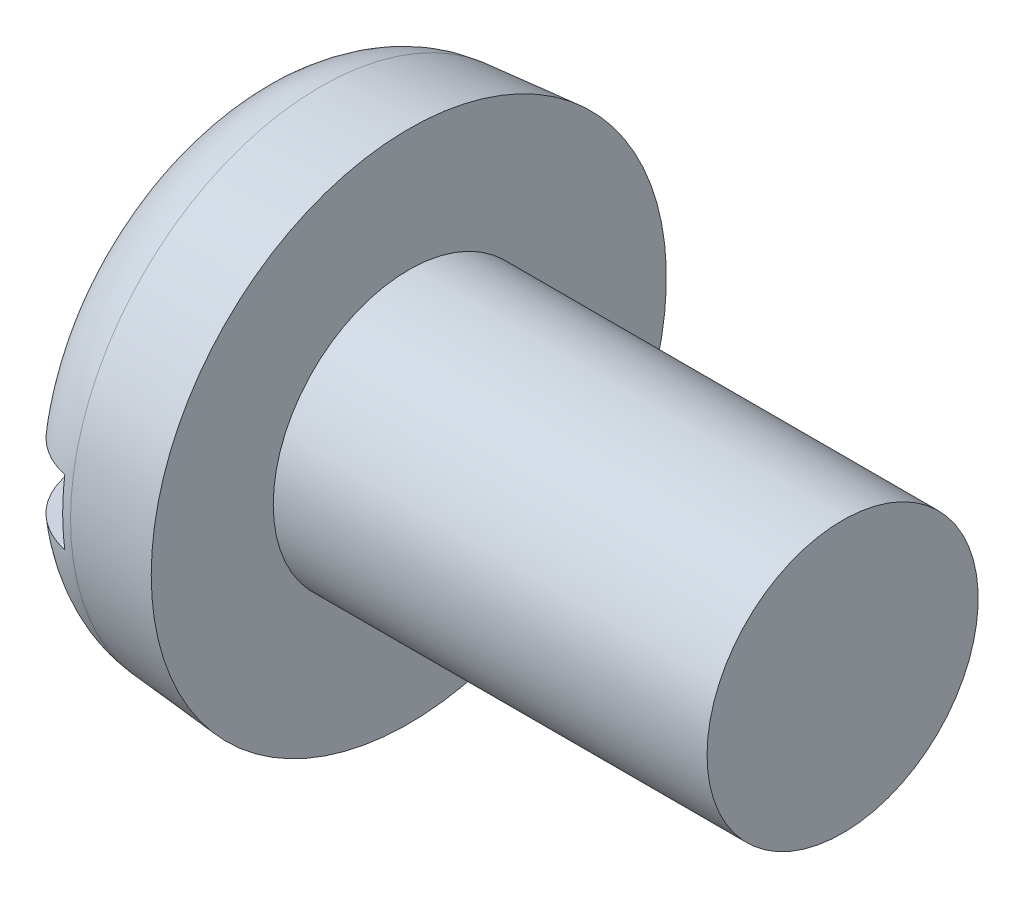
SolidWorks part; units mm, degrees
ref_plane "Plane1" through (0, 0, 0) normal (0, 0, 1) x (1, 0, 0)
ref_plane "Plane2" through (0, 0, 0) normal (0, 1, 0) x (1, 0, 0)
ref_plane "Plane3" through (0, 0, 0) normal (1, 0, 0) x (0, 0, -1)
sketch "BodySke" plane through (0, 0, 0) normal (0, 0, 1) x (1, 0, 0)
  line L0 (3, 2.5) -> (3, 4.75)
  line L1 (0, 0) -> (0, 4.4875)
  line L2 (-25.4, 0) -> (127, 0) construction
  line L3 (11, 0) -> (0, 0)
  line L4 (3, 2.5) -> (11, 2.5)
  line L5 (11, 2.5) -> (11, 0)
  line L6 (0, 4.4875) -> (3, 4.75)
  line L9 (3.8, 4.0875) -> (3.8, -5.4375) construction
  line L10 (3, 6.35) -> (3, -3.175) construction
  dimension "Head_ht" = 3
  dimension "Diameter" = 5
  dimension "Length" = 8
  dimension "Head_dia" = 9.5
  dimension "Advance" = 0.8
  dimension "Thread_nom" = 8
  dimension "Head_side_angle" = 5
revolve "Base-Revolve" add sketch "BodySke"
fillet "Fillet1" [suppressed] radius 0.2
fillet "Fillet2" radius 1.5 1 edges at (0, 0, 4.4875)
sketch "Sketch2" plane through (0, 0, 0) normal (1, 0, 0) x (0, 0, -1)
  line L0 (4.75, -0.6) -> (-4.75, -0.6)
  line L1 (4.75, -0.6) -> (4.75, 0.6)
  line L2 (-4.75, 0.6) -> (4.75, 0.6)
  line L3 (-4.75, 0.6) -> (-4.75, -0.6)
  dimension "D1" = 9.5
  dimension "D2" = 4.75
  dimension "Slot_width" = 1.2
  dimension "D3" = 0.6
extrude "Slot" cut sketch "Sketch2" along normal blind 1.2
sketch "ThdSchSke" plane through (0, 0, 0) normal (0, 0, 1) x (1, 0, 0)
  line L0 (4.6, -2.055) -> (4.2884, -2.5)
  line L1 (4.6, -2.055) -> (4.9116, -2.5)
  line L2 (4.9116, -2.5) -> (4.9116, -3.125)
  line L3 (-3.175, 0) -> (5.1513, 0) construction
  line L5 (4.9116, -3.125) -> (4.2884, -3.125)
  line L6 (4.2884, -3.125) -> (4.2884, -2.5)
  dimension "Thread_minor" = 4.11
  dimension "Diameter" = 5
  dimension "Start" = 4.6
  dimension "SideAngle" = 55
  dimension "VeeAngle" = 70
  dimension "Overcut" = 6.25
revolve "ThreadSchematic" [suppressed] cut sketch "ThdSchSke" angle 360 about L3
pattern_linear "ThdSchPat" [suppressed]
equation "\"D1@Sketch2\" = \"Head_dia@BodySke\""
equation "\"D2@Sketch2\" = \"D1@Sketch2\" / 2"
equation "\"D3@Sketch2\" = \"Slot_width@Sketch2\" / 2"
equation "\"Thread_length@ThreadCosmetic\" = ((sgn( (\"Length@BodySke\" - \"Advance@BodySke\" * 2.0 ) - \"Thread_nom@BodySke\" )-1)*( (\"Length@BodySke\" - \"Advance@BodySke\"  * 2.0) - \"Thread_nom@BodySke\" ))/-2+ \"Thread_"
equation "\"Thread_minor@ThdSchSke\" = \"Thread_minor@ThreadCosmetic\""
equation "\"Diameter@ThdSchSke\" = \"Diameter@BodySke\""
equation "\"Overcut@ThdSchSke\" = \"Diameter@BodySke\" * 1.25"
equation "\"Start@ThdSchSke\" = \"Head_ht@BodySke\" + \"Length@BodySke\" - \"Thread_length@ThreadCosmetic\"  '---Non-countersunk---"
equation "\"Num_threads@ThdSchPat\" = int( \"Thread_length@ThreadCosmetic\" / \"Advance@BodySke\" + 0.999 )  + 1"
equation "\"Advance@ThdSchPat\" = \"Thread_length@ThreadCosmetic\" /  (\"Num_threads@ThdSchPat\" - 1) 'relax it"
